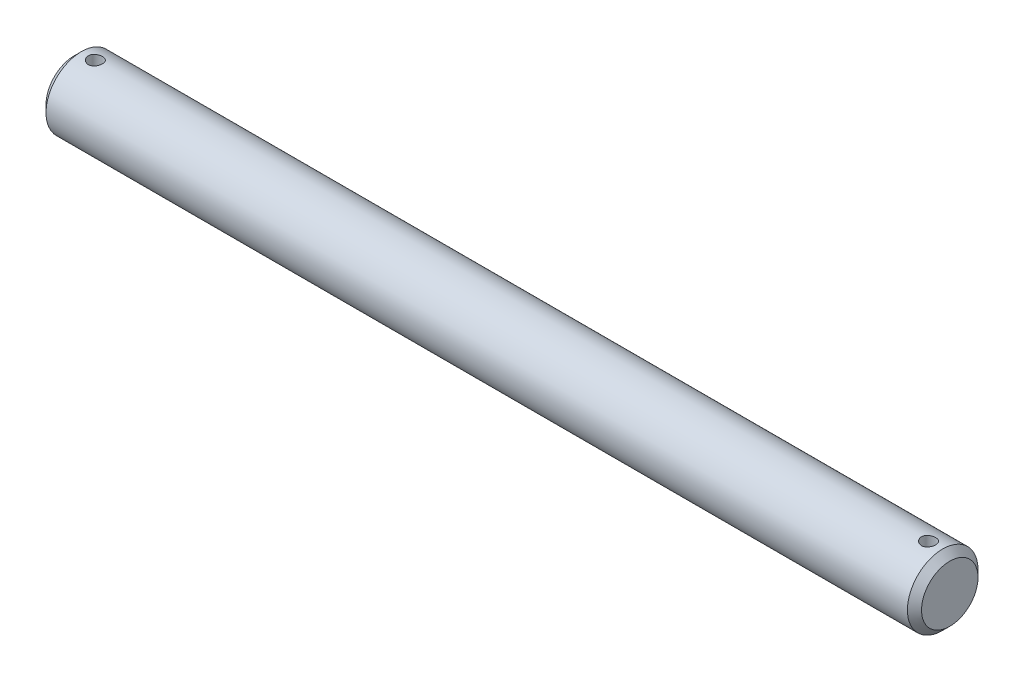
SolidWorks part; units mm, degrees
ref_plane "Alzado" through (0, 0, 0) normal (0, 0, 1) x (1, 0, 0)
ref_plane "Planta" through (0, 0, 0) normal (0, 1, 0) x (1, 0, 0)
ref_plane "Vista lateral" through (0, 0, 0) normal (1, 0, 0) x (0, 0, -1)
sketch "Croquis1" plane through (0, 0, 0) normal (1, 0, 0) x (0, 0, -1)
  circle A0 centre (0, 0) radius 50
  dimension "D1" = 100
extrude "Saliente-Extruir1" add sketch "Croquis1" along normal blind 1240 contours A0
sketch "Croquis2" plane through (0, 0, 0) normal (0, 1, 0) x (1, 0, 0)
  line L0 (0, 0) -> (1240, 0) construction
  line L1 (1240, -50) -> (1240, 50) construction
  line L2 (0, 50) -> (0, -50) construction
  circle A0 centre (30, 0) radius 10
  circle A1 centre (1210, 0) radius 10
  dimension "D1" = 20
  dimension "D2" = 30
  dimension "D3" = 30
extrude "Cortar-Extruir1" cut sketch "Croquis2" against normal through all both and the other way through all
chamfer "Chaflán1" distance 10 angle 45 2 edges at (1240, 0, -50) (0, 0, -50)
